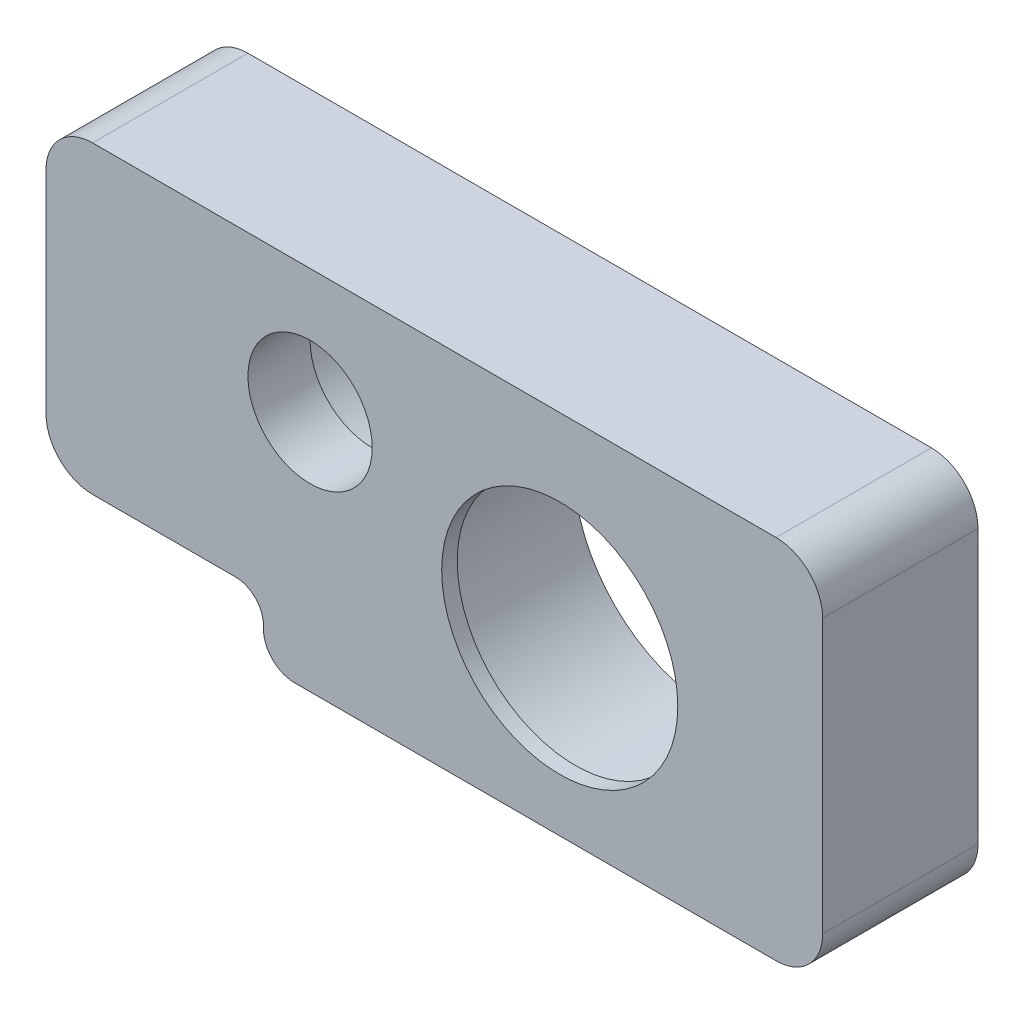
SolidWorks part; units mm, degrees
ref_plane "Plano frontal" through (0, 0, 0) normal (0, 0, 1) x (1, 0, 0)
ref_plane "Plano superior" through (0, 0, 0) normal (0, 1, 0) x (1, 0, 0)
ref_plane "Plano direito" through (0, 0, 0) normal (1, 0, 0) x (0, 0, -1)
sketch "Esboço1" plane through (0, 0, 0) normal (0, 0, 1) x (1, 0, 0)
  line L0 (-5.5, -4.8) -> (-5.5, -4.9)
  line L2 (-12.5, -2.4) -> (-12.5, 4.4)
  line L3 (-11, 5.9) -> (11, 5.9)
  line L5 (0, 0) -> (0, 8.0295) construction
  line L6 (0, 0) -> (16.4431, 0) construction
  line L7 (-4.5, -5.9) -> (11, -5.9)
  line L8 (12.5, -4.4) -> (12.5, 4.4)
  line L9 (-11, -3.9) -> (-6.4, -3.9)
  arc A10 (12.5, -4.4) -> (11, -5.9) centre (11, -4.4) cw
  arc A11 (11, 5.9) -> (12.5, 4.4) centre (11, 4.4) cw
  arc A12 (-12.5, -2.4) -> (-11, -3.9) centre (-11, -2.4) ccw
  arc A13 (-12.5, 4.4) -> (-11, 5.9) centre (-11, 4.4) cw
  arc A14 (-5.5, -4.8) -> (-6.4, -3.9) centre (-6.4, -4.8) ccw
  arc A15 (-4.5, -5.9) -> (-5.5, -4.9) centre (-4.5, -4.9) cw
  point P0 (0, 0)
  point P1 (0, 5.9)
  point P6 (12.5, 0)
  dimension "D3" = 0.9
  dimension "D4" = 2
  dimension "D5" = 18
  dimension "D6" = 1
  dimension "D7" = 1.5
  dimension "D1" = 9.8
  dimension "D2" = 25
extrude "Ressalto-extrusão1" add sketch "Esboço1" along normal blind 5
sketch "Esboço2" plane through (0, 0, 5) normal (0, 0, 1) x (1, 0, 0)
  circle A1 centre (4.0367, -0.3872) radius 3.25 construction
  circle A2 centre (4.0367, -0.3872) radius 3.25 construction
  circle A4 centre (-4, 1.9) radius 1.2295 construction
  circle A5 centre (-4, 1.9) radius 1.2295 construction
  circle A6 centre (-4, 1.9) radius 2
  circle A7 centre (4.0367, -0.3872) radius 3.8
  dimension "D1" = 7.6
  dimension "D2" = 4
extrude "Corte-extrusão1" cut sketch "Esboço2" against normal blind 5 contours A6
sketch "Esboço3" plane through (0, 0, 0) normal (0, 0, -1) x (-1, 0, 0)
  circle A0 centre (4, 1.9) radius 3.1
  dimension "D1" = 6.2
extrude "Corte-extrusão2" cut sketch "Esboço3" against normal blind 3
sketch "Esboço4" plane through (0, 0, 0) normal (0, 0, -1) x (-1, 0, 0)
  circle A1 centre (-4.0367, -0.3872) radius 4.55
  dimension "D1" = 9.1
extrude "Corte-extrusão3" cut sketch "Esboço4" against normal offset from surface (4.5 mm away) 0.5
